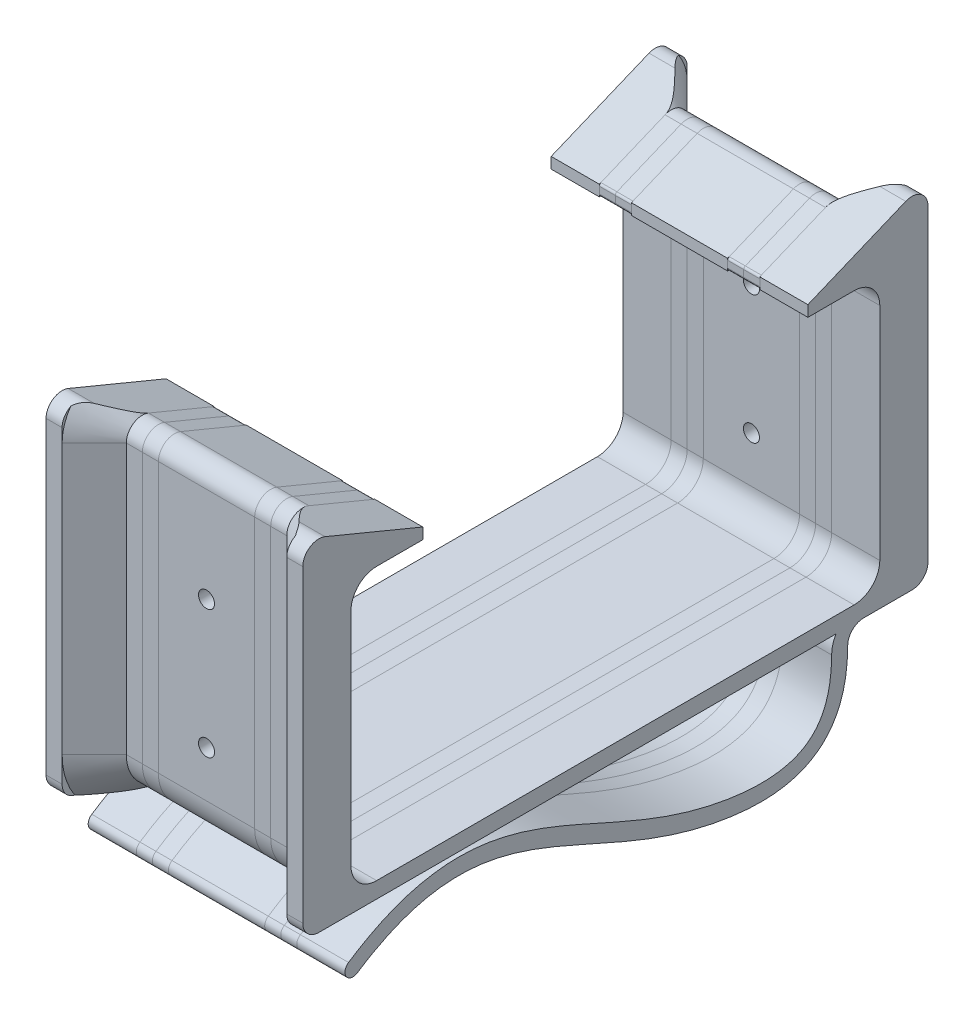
SolidWorks part; units mm, degrees
other "Markup1"
sketch "Sketch7" plane through (-12.7, 17.7179, -30.1625) normal (-0.2414, 0.8298, -0.5031) x (-0.9244, -0.0389, 0.3793)
ref_plane "Front Plane" through (0, 0, 0) normal (0, 0, 1) x (1, 0, 0)
ref_plane "Top Plane" through (0, 0, 0) normal (0, 1, 0) x (1, 0, 0)
ref_plane "Right Plane" through (0, 0, 0) normal (1, 0, 0) x (0, 0, -1)
sketch "Sketch1" plane through (0, 0, 0) normal (1, 0, 0) x (0, 0, -1)
  line L0 (-23.622, -13.462) -> (23.622, -13.462)
  line L1 (-26.162, -10.922) -> (-26.162, 10.922)
  line L2 (-23.622, 13.462) -> (23.622, 13.462)
  line L3 (26.162, -10.922) -> (26.162, 10.922)
  line L4 (-26.162, -13.462) -> (26.162, 13.462) construction
  line L5 (-26.162, 13.462) -> (26.162, -13.462) construction
  arc A0 (-23.622, -13.462) -> (-26.162, -10.922) centre (-23.622, -10.922) cw
  arc A1 (23.622, -13.462) -> (26.162, -10.922) centre (23.622, -10.922) ccw
  arc A2 (23.622, 13.462) -> (26.162, 10.922) centre (23.622, 10.922) cw
  arc A3 (-26.162, 10.922) -> (-23.622, 13.462) centre (-23.622, 10.922) cw
  point P0 (0, 0)
  dimension "D3" = 2.54
  dimension "D1" = 52.324
  dimension "D2" = 26.924
extrude "Extrude-Thin1" add sketch "Sketch1" along normal mid plane 25.4 thin
sketch "Sketch2" plane through (12.7, 0, 0) normal (1, 0, 0) x (0, 0, -1)
  line L0 (23.622, 13.462) -> (-23.622, 13.462) construction
  line L1 (-19.05, 13.462) -> (19.05, 13.462)
  line L2 (-19.05, 13.462) -> (-19.05, 15.0495)
  line L3 (-19.05, 15.0495) -> (19.05, 15.0495)
  line L4 (19.05, 13.462) -> (19.05, 15.0495)
  line L5 (23.622, 15.0495) -> (-23.622, 15.0495) construction
  point P8 (0, 13.462)
  dimension "D1" = 38.1
extrude "Cut-Extrude1" cut sketch "Sketch2" against normal through all
sketch "Sketch3" plane through (12.7, 0, 0) normal (1, 0, 0) x (0, 0, -1)
  line L0 (-27.7495, 10.922) -> (-27.7495, 19.812)
  line L1 (-27.7495, 19.812) -> (-19.05, 19.812)
  line L2 (-19.05, 19.812) -> (-19.05, 13.462)
  line L3 (27.7495, 10.922) -> (27.7495, 19.812)
  line L4 (27.7495, 19.812) -> (19.05, 19.812)
  line L5 (19.05, 19.812) -> (19.05, 13.462)
  line L6 (-19.05, 15.0495) -> (-19.05, 13.462) construction
  line L7 (19.05, 13.462) -> (19.05, 15.0495) construction
  line L8 (-19.05, 13.462) -> (-23.622, 13.462) construction
  line L9 (23.622, 15.0495) -> (19.05, 15.0495) construction
  line L10 (-19.05, 15.0495) -> (-23.622, 15.0495) construction
  line L11 (23.622, 15.0495) -> (19.05, 15.0495)
  line L12 (-19.05, 15.0495) -> (-23.622, 15.0495)
  arc A0 (27.7495, 10.922) -> (23.622, 15.0495) centre (23.622, 10.922) ccw construction
  arc A1 (-23.622, 15.0495) -> (-27.7495, 10.922) centre (-23.622, 10.922) ccw construction
  arc A2 (27.7495, 10.922) -> (23.622, 15.0495) centre (23.622, 10.922) ccw
  arc A3 (-23.622, 15.0495) -> (-27.7495, 10.922) centre (-23.622, 10.922) ccw
  dimension "D1" = 6.35
extrude "Boss-Extrude1" add sketch "Sketch3" against normal through all contours L2 L1 L0 M8 M7 | L4 L5 L3 M15 M14
chamfer "Chamfer1" distance 12.7 angle 22.5 2 edges at (0, 19.812, -19.05) (0, 19.812, 19.05)
sketch "Sketch4" plane through (12.7, 0, 0) normal (1, 0, 0) x (0, 0, -1)
  line L0 (-27.7495, 18.1549) -> (-30.9245, 19.4701)
  line L1 (-27.7495, 18.1549) -> (-27.7495, -10.922) construction
  line L2 (-19.05, 14.5515) -> (-27.7495, 18.1549) construction
  line L3 (-30.9245, 19.4701) -> (-30.9245, -15.0495)
  line L4 (-30.9245, -15.0495) -> (-23.622, -15.0495)
  line L5 (-23.622, -15.0495) -> (23.622, -15.0495) construction
  line L6 (-26.162, 10.922) -> (-26.162, -10.922) construction
  line L7 (0, 0) -> (0, -13.462) construction
  line L8 (-23.622, -13.462) -> (23.622, -13.462) construction
  line L9 (-27.7495, 18.1549) -> (-27.7495, -10.922)
  line L10 (27.7495, 18.1549) -> (27.7495, -10.922)
  line L11 (30.9245, -15.0495) -> (23.622, -15.0495)
  line L12 (30.9245, 19.4701) -> (30.9245, -15.0495)
  line L13 (27.7495, 18.1549) -> (30.9245, 19.4701)
  arc A0 (-27.7495, -10.922) -> (-23.622, -15.0495) centre (-23.622, -10.922) ccw construction
  arc A1 (-27.7495, -10.922) -> (-23.622, -15.0495) centre (-23.622, -10.922) ccw
  arc A2 (27.7495, -10.922) -> (23.622, -15.0495) centre (23.622, -10.922) cw
  dimension "D1" = 4.7625
extrude "Boss-Extrude2" add sketch "Sketch4" against normal blind 1.5875 contours L3 L4 L0 M27 M26 | L13 L11 L12 M12 M29
mirror "Mirror1" about plane through (0, 0, 0) normal (1, 0, 0) of "Boss-Extrude2"
fillet "Fillet1" radius 1.5875 10 edges at (0, 18.1549, 27.7495) (11.9062, -15.0495, 30.9245) (11.9062, 19.4701, 30.9245) (11.9062, 19.4701, -30.9245) (11.9062, -15.0495, -30.9245) (-11.9062, 19.4701, 30.9245) (-11.9062, -15.0495, 30.9245) (0, 18.1549, -27.7495) (-11.9062, 19.4701, -30.9245) (-11.9062, -15.0495, -30.9245)
sketch "Sketch5" plane through (12.7, 0, 0) normal (1, 0, 0) x (0, 0, -1)
  line L0 (-29.337, -15.0495) -> (29.337, -15.0495) construction
  line L2 (26.162, -10.922) -> (26.162, 10.922) construction
  line L6 (-26.162, 10.922) -> (-26.162, -10.922) construction
  arc A0 (24.5745, -15.0495) -> (22.987, -16.637) centre (24.5745, -16.637) ccw
  spline S0 degree 3 poles (22.987, -16.637) (22.987, -25.8704) (-0.5857, -27.5815) (-12.3512, -11.1577) (-26.162, -20.8467) knots 0 0 0 0 0.28086 1 1 1 1
  dimension "D1" = 1.5875
  dimension "D2" = 1.5875
extrude "Extrude-Thin2" add sketch "Sketch5" against normal through all thin
fillet "Fillet2" radius 0.7935 2 edges at (0, -20.8467, 26.162) (0, -19.5471, 27.0737)
chamfer "Chamfer2" distance 3.175 angle 45 12 edges at (11.1125, -13.4818, -26.8599) (11.1125, 17.099, -27.044) (11.1125, 2.4285, -27.7495) (-11.1125, -13.4818, -26.8599) (-11.1125, 17.099, -27.044) (-11.1125, 2.4285, -27.7495) (11.1125, 17.099, 27.044) (11.1125, -13.8406, 26.5406) (11.1125, 2.4285, 27.7495) (-11.1125, 17.099, 27.044) (-11.1125, -13.8406, 26.5406) (-11.1125, 2.4285, 27.7495)
sketch "Sketch6" plane through (0, 0, 0) normal (0, 0, 1) x (1, 0, 0)
  line L0 (0, -6.35) -> (0, 6.35) construction
  line L1 (0, 6.35) -> (0, 13.462) construction
  line L3 (0, -6.35) -> (0, -13.462) construction
  line L5 (12.7, -13.462) -> (-12.7, -13.462) construction
  line L6 (12.7, 13.462) -> (-12.7, 13.462) construction
  circle A0 centre (0, 6.35) radius 0.7937
  circle A1 centre (0, -6.35) radius 0.7937
  dimension "D1" = 1.5875
  dimension "D2" = 12.7
extrude "Cut-Extrude2" cut sketch "Sketch6" against normal through all both and the other way through all
ref_plane "Plane1" through (6.35, 0, 0) normal (1, 0, 0) x (0, 0, -1)
ref_plane "Plane2" through (-6.35, 0, 0) normal (1, 0, 0) x (0, 0, -1)
ref_plane "Plane3" through (7.9375, 0, 0) normal (1, 0, 0) x (0, 0, -1)
ref_plane "Plane4" through (4.7625, 0, 0) normal (1, 0, 0) x (0, 0, -1)
ref_plane "Plane5" through (-4.7625, 0, 0) normal (1, 0, 0) x (0, 0, -1)
ref_plane "Plane6" through (-7.9375, 0, 0) normal (1, 0, 0) x (0, 0, -1)
split "Split1" trim tools "Plane6", "Plane2", "Plane5", "Plane4", "Plane1", "Plane3" bodies to split 107 resulting bodies 108 109 110 111 112 113 114
fillet "Fillet3" radius 0.254 4 edges at (-7.1437, 13.462, 19.05) (-7.1437, 13.462, -19.05) (-7.1437, 14.5515, -19.05) (-7.1437, 14.5515, 19.05)
fillet "Fillet4" radius 0.254 4 edges at (-5.5562, 13.462, 19.05) (-5.5562, 13.462, -19.05) (-5.5562, 14.5515, -19.05) (-5.5562, 14.5515, 19.05)
fillet "Fillet5" radius 0.254 4 edges at (5.5562, 13.462, 19.05) (5.5562, 13.462, -19.05) (5.5562, 14.5515, -19.05) (5.5562, 14.5515, 19.05)
fillet "Fillet6" radius 0.254 4 edges at (7.1437, 13.462, 19.05) (7.1437, 13.462, -19.05) (7.1437, 14.5515, -19.05) (7.1437, 14.5515, 19.05)
equation "\"0.031i2n\"=0.031"
